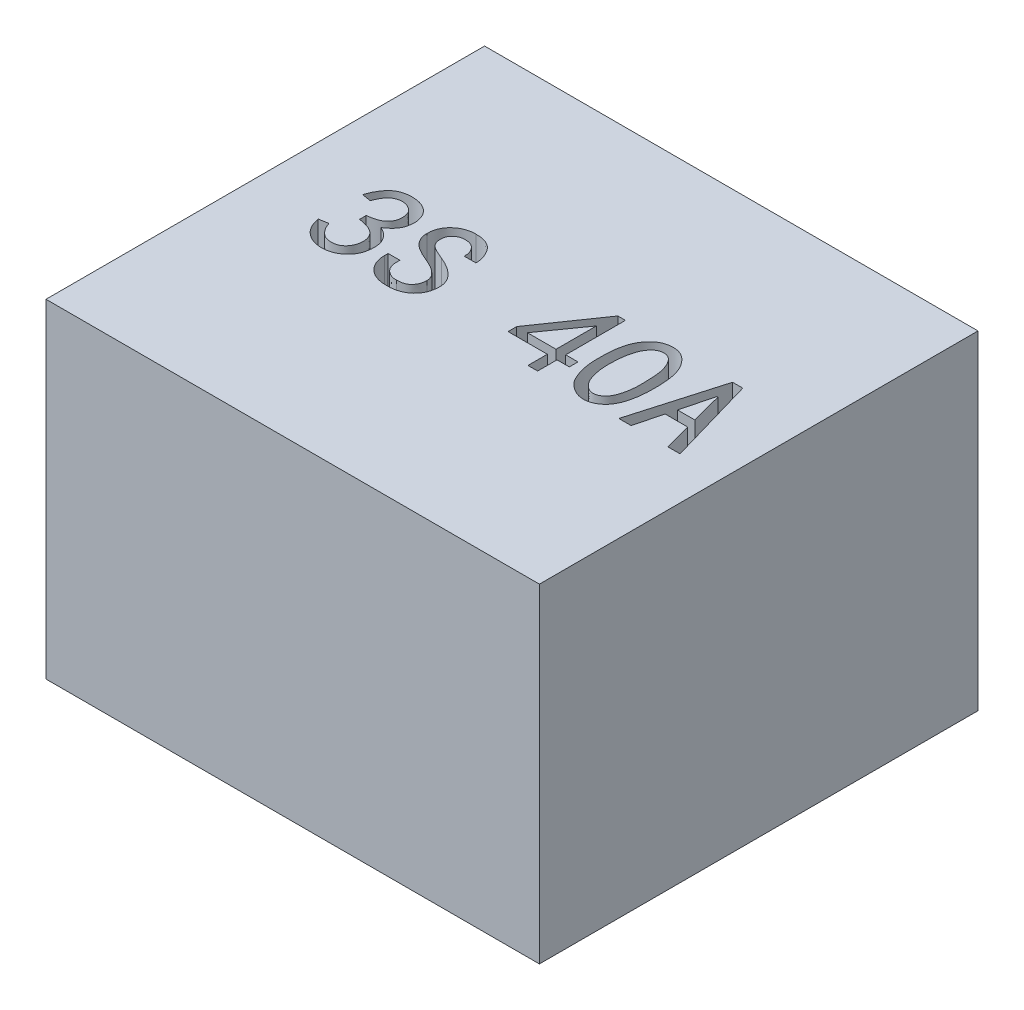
SolidWorks part; units mm, degrees
ref_plane "前视基准面" through (0, 0, 0) normal (0, 0, 1) x (1, 0, 0)
ref_plane "上视基准面" through (0, 0, 0) normal (0, 1, 0) x (1, 0, 0)
ref_plane "右视基准面" through (0, 0, 0) normal (1, 0, 0) x (0, 0, -1)
other "Configuration Table"
sketch "草图1" plane through (0, 0, 0) normal (0, 1, 0) x (1, 0, 0)
  line L1 (-36, 32) -> (36, 32)
  line L2 (-36, 32) -> (-36, -32)
  line L3 (-36, -32) -> (36, -32)
  line L4 (36, 32) -> (36, -32)
  line L5 (0, -32) -> (0, 32) construction
  line L6 (-36, 0) -> (36, 0) construction
  point P0 (0, 0)
  dimension "D1" = 72
  dimension "D2" = 64
extrude "凸台-拉伸1" add sketch "草图1" along normal blind 48
sketch "草图2" plane through (0, 48, 0) normal (0, 1, 0) x (1, 0, 0)
  text T0 "3S 40A" font "楷体" height in points 42
extrude "切除-拉伸1" cut sketch "草图2" against normal blind 10
